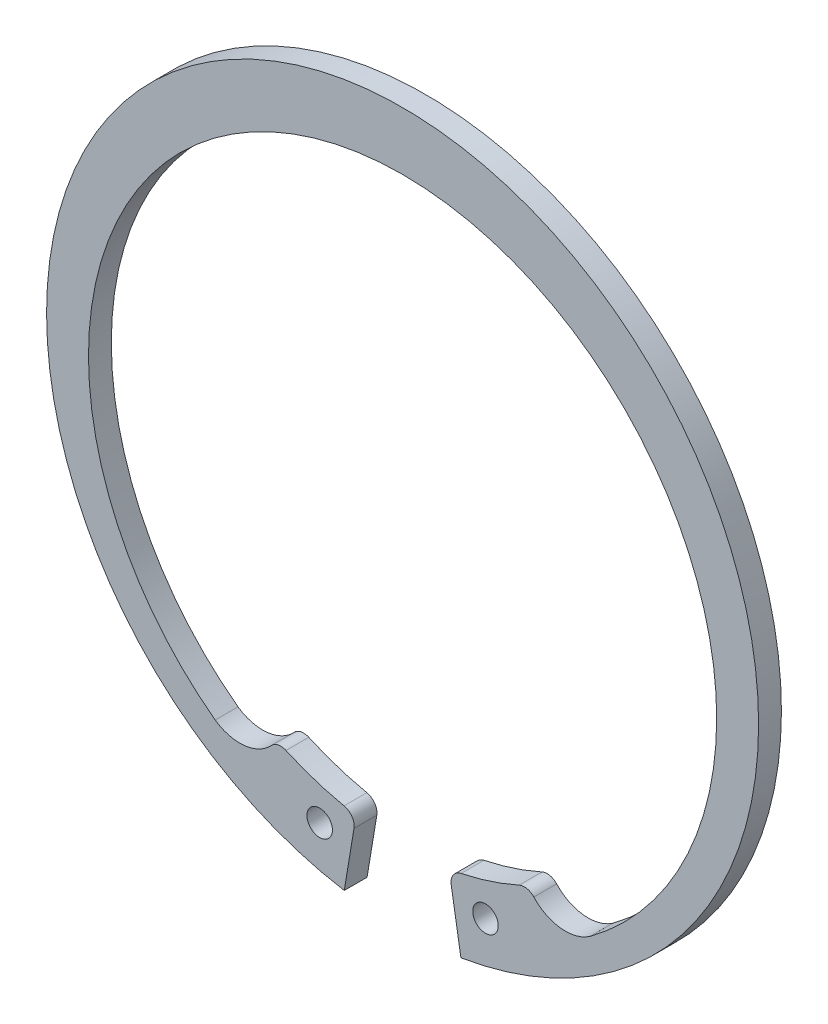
SolidWorks part; units mm, degrees
ref_plane "Plane1" through (0, 0, 0) normal (0, 0, 1) x (1, 0, 0)
ref_plane "Plane2" through (0, 0, 0) normal (0, 1, 0) x (1, 0, 0)
ref_plane "Plane3" through (0, 0, 0) normal (1, 0, 0) x (0, 0, -1)
extrude "Body" add sketch "BodySke" against normal blind 2.5
sketch "BodySke" plane through (0, 0, 0) normal (0, 0, 1) x (1, 0, 0)
  line L0 (-1.5431, 0) -> (1.5431, 0) construction
  line L1 (0, 0) -> (0, 32.65) construction
  line L2 (6.3893, -38.4731) -> (5.6418, -33.9716)
  line L3 (-6.3893, -38.4731) -> (-5.6418, -33.9716)
  line L4 (0, 0) -> (20.1795, -33.3735) construction
  line L5 (0, 0) -> (-20.1795, -33.3735) construction
  line L6 (-8.8528, -32.0222) -> (-9.3105, -34.7785) construction
  line L7 (8.9587, -32.6599) -> (9.2046, -34.1408) construction
  line L8 (0, 0) -> (0, -41.5375) construction
  arc A0 (-5.6418, -33.9716) -> (-11.0431, -30.5173) centre (-9.0817, -33.4003) ccw
  arc A1 (11.0431, -30.5173) -> (5.6418, -33.9716) centre (9.0817, -33.4003) ccw
  arc A2 (18.5761, -30.7217) -> (-18.5761, -30.7217) centre (0, -1.7585) ccw construction
  arc A3 (6.3893, -38.4731) -> (-6.3893, -38.4731) centre (0, 0) ccw
  circle A4 centre (9.0817, -33.4003) radius 1.397
  circle A5 centre (-9.0817, -33.4003) radius 1.397
  arc A7 (18.7705, -30.5961) -> (-18.7705, -30.5961) centre (0, -1.7585) ccw
  arc A8 (-9.0817, -33.4003) -> (9.0817, -33.4003) centre (0, 0) ccw construction
  arc A9 (-18.7705, -30.5961) -> (-11.0431, -30.5173) centre (-14.966, -24.7512) ccw
  arc A10 (11.0431, -30.5173) -> (18.7705, -30.5961) centre (14.966, -24.7512) ccw
  dimension "GrooveDia" = 78
  dimension "TipRad" = 3.487
  dimension "HoleOffsetRad" = 34.613
  dimension "HoleDia" = 2.794
  dimension "FilletRad" = 6.974
  dimension "LargeRad" = 32.65
  dimension "SmallRad" = 35.9012
  dimension "SmallAngle" = 62.319
  dimension "GapAngle" = 18.858
sketch "Clipboard" plane through (0, 0, 0) normal (0, 0, 1) x (1, 0, 0)
  line L0 (0, 0) -> (6.35, 0)
  line L1 (0, 0) -> (0, 3.0988)
  line L2 (0, 0) -> (0, -7.874)
  circle A0 centre (0, 0) radius 1.397
  circle A1 centre (0, 0) radius 38.1
  dimension "HoleDia" = 2.794
  dimension "BoreDia" = 76.2
  dimension "LargeSection" = 6.35
  dimension "SmallSection" = 3.0988
  dimension "LugSection" = 7.874
sketch "ModLugSke" plane through (0, 0, 0) normal (0, 0, 1) x (1, 0, 0)
  line L0 (6.3893, -38.4731) -> (5.3233, -32.054)
  line L1 (-6.3893, -38.4731) -> (-5.3233, -32.054)
  line L2 (17.8292, -25.5137) -> (22.3394, -31.9679) construction
  line L3 (-17.8292, -25.5137) -> (-22.3394, -31.9679) construction
  line L4 (-6.3893, -38.4731) -> (-5.6418, -33.9716) construction
  line L5 (5.6418, -33.9716) -> (6.3893, -38.4731) construction
  line L6 (0, 0) -> (0, -12.7358) construction
  line L7 (20.5252, -29.3718) -> (22.3394, -31.9679)
  line L8 (-22.3394, -31.9679) -> (-20.5252, -29.3718)
  arc A0 (6.3893, -38.4731) -> (22.3394, -31.9679) centre (0, 0) ccw
  arc A1 (-12.7744, -28.3838) -> (-6.4136, -30.4581) centre (0, 0) ccw
  arc A2 (6.3893, -38.4731) -> (-6.3893, -38.4731) centre (0, 0) ccw construction
  arc A3 (11.0431, -30.5173) -> (5.6418, -33.9716) centre (9.0817, -33.4003) ccw construction
  arc A4 (-12.7744, -28.3838) -> (-14.3734, -28.7093) centre (-13.3478, -29.6578) ccw
  arc A5 (-20.5252, -29.3718) -> (-14.3734, -28.7093) centre (-17.8292, -25.5137) ccw
  arc A6 (18.7705, -30.5961) -> (-18.7705, -30.5961) centre (0, -1.7585) ccw construction
  arc A7 (14.3734, -28.7093) -> (20.5252, -29.3718) centre (17.8292, -25.5137) ccw
  arc A8 (6.4136, -30.4581) -> (12.7744, -28.3838) centre (0, 0) ccw
  arc A9 (-22.3394, -31.9679) -> (-6.3893, -38.4731) centre (0, 0) ccw
  circle A10 centre (-9.0817, -33.4003) radius 1.397
  circle A11 centre (-9.0817, -33.4003) radius 1.397 construction
  circle A12 centre (9.0817, -33.4003) radius 1.397
  circle A13 centre (9.0817, -33.4003) radius 1.397 construction
  arc A14 (-6.4136, -30.4581) -> (-5.3233, -32.054) centre (-6.7014, -31.8251) cw
  arc A15 (6.4136, -30.4581) -> (5.3233, -32.054) centre (6.7014, -31.8251) ccw
  arc A16 (12.7744, -28.3838) -> (14.3734, -28.7093) centre (13.3478, -29.6578) cw
  point P43 (5.0993, -30.7054)
  dimension "LugAng" = 48.461
extrude "ModLug" add sketch "ModLugSke" against normal through all
sketch "Esquisse1" plane through (0, 0, 0) normal (0, 0, 1) x (1, 0, 0)
  line L1 (42.4089, 47.3308) -> (0, 47.3308)
  line L2 (42.4089, 47.3308) -> (42.4089, -45.4566)
  line L3 (42.4089, -45.4566) -> (0, -45.4566)
  line L4 (0, 47.3308) -> (0, -45.4566)
extrude "Coupe" [suppressed] cut sketch "Esquisse1" against normal through all
equation "' \"BoreDia@Clipboard\" = 0.25"
equation "' \"Thickness@Body\" = 0.015"
equation "' \"GrooveDia@BodySke\" = 0.268"
equation "' \"LugSection@Clipboard\" = 0.065"
equation "' \"LargeSection@Clipboard\" = 0.025"
equation "' \"SmallSection@Clipboard\" = 0.015"
equation "' \"HoleDia@Clipboard\" = 0.031"
equation "' \"BoreDia@Clipboard\" = 1.0"
equation "' \"Thickness@Body\" = 0.042"
equation "' \"GrooveDia@BodySke\" = 1.066"
equation "' \"LugSection@Clipboard\" = 0.155"
equation "' \"LargeSection@Clipboard\" = 0.104"
equation "' \"SmallSection@Clipboard\" = 0.052"
equation "' \"HoleDia@Clipboard\" = 0.062"
equation "\"TipRad@BodySke\" = (\"LugSection@Clipboard\" - (\"GrooveDia@BodySke\" / 2  -  \"BoreDia@Clipboard\" / 2 ) ) / 2"
equation "\"HoleOffsetRad@BodySke\" = (\"GrooveDia@BodySke\" / 2) - \"LugSection@Clipboard\"  + \"TipRad@BodySke\""
equation "\"LargeRad@BodySke\" =  \"GrooveDia@BodySke\" / 2 -  \"LargeSection@Clipboard\""
equation "\"SmallRad@BodySke\" =  \"GrooveDia@BodySke\" / 2 -  \"SmallSection@Clipboard\""
equation "\"HoleDia@BodySke\" =  \"HoleDia@Clipboard\""
equation "\"FilletRad@BodySke\" = \"TipRad@BodySke\" * 2"
equation "\"GapAngle@BodySke\" = 360 - 0.97 * 360 * ( \"BoreDia@Clipboard\" /  \"GrooveDia@BodySke\")"
equation "\"LugAng@ModLugSke\" = \"GapAngle@BodySke\"  + 2.5 * 360 * (\"LugSection@Clipboard\" / (\"BoreDia@Clipboard\" * 3.1416))"
